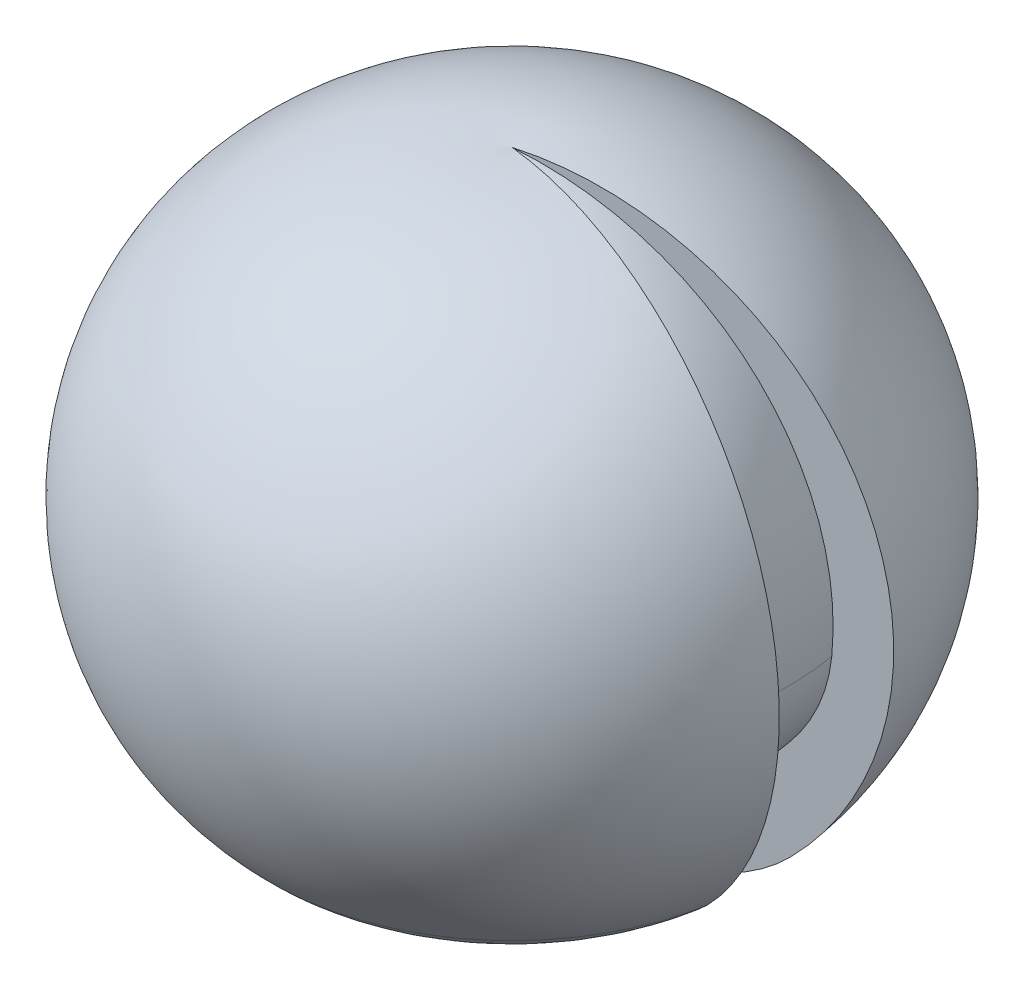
SolidWorks part; units mm, degrees
ref_plane "Front" through (0, 0, 0) normal (0, 0, 1) x (1, 0, 0)
ref_plane "Top" through (0, 0, 0) normal (0, 1, 0) x (1, 0, 0)
ref_plane "Right" through (0, 0, 0) normal (1, 0, 0) x (0, 0, -1)
sketch "Sketch1" plane through (0, 0, 0) normal (0, 0, 1) x (1, 0, 0)
  line L0 (0, 0) -> (0, 365) construction
  line L1 (0, 365) -> (-50, 365) construction
  line L2 (-50, 365) -> (-50, 635) construction
  line L3 (-50, 635) -> (-50, 685) construction
  line L4 (-50, 685) -> (-355.9412, 685) construction
  line L5 (-355.9412, 685) -> (-50, 635) construction
  line L6 (-50, 635) -> (0, 635) construction
  dimension "D1" = 365
  dimension "D2" = 270
  dimension "D3" = 50
  dimension "D4" = 50
  dimension "D5" = 310
  dimension "D6" = 90
sketch "Sketch2" plane through (0, 0, 0) normal (0, 0, 1) x (1, 0, 0)
  line L0 (0, 0) -> (0, 365) construction
  line L1 (0, 365) -> (-50, 365) construction
  line L2 (-50, 365) -> (-240.9188, 174.0812) construction
  line L3 (-240.9188, 174.0812) -> (-223.8178, 127.0965) construction
  line L4 (-223.8178, 127.0965) -> (63.6728, 231.7346) construction
  line L5 (63.6728, 231.7346) -> (-240.9188, 174.0812) construction
  line L6 (-50, 365) -> (-50, 635) construction
  line L7 (-50, 635) -> (-50, 685) construction
  line L8 (-355.9412, 685) -> (-50, 635) construction
  line L9 (-240.9188, 174.0812) -> (-276.2742, 209.4365) construction
  dimension "D1" = 135
  dimension "D2" = 155
sketch "Sketch3" plane through (0, 0, 0) normal (0, 0, 1) x (1, 0, 0)
  line L0 (0, 0) -> (0, 365) construction
  line L1 (0, 365) -> (-50, 365) construction
  line L2 (-50, 365) -> (-240.9188, 174.0812) construction
  line L3 (-240.9188, 174.0812) -> (-281.5137, 203.2711) construction
  line L4 (-281.5137, 203.2711) -> (-460.1219, -45.1219) construction
  line L5 (-460.1219, -45.1219) -> (-240.9188, 174.0812) construction
  line L6 (-50, 365) -> (-50, 635) construction
  line L7 (-355.9412, 685) -> (-50, 635) construction
  line L8 (-50, 635) -> (-50, 685) construction
  line L9 (-240.9188, 174.0812) -> (-276.2742, 209.4365) construction
  dimension "D1" = 135
  dimension "D2" = 9.282
sketch "Sketch4" plane through (0, 0, 0) normal (0, 0, 1) x (1, 0, 0)
  line L0 (0, 0) -> (0, 365) construction
  line L1 (0, 365) -> (-50, 365) construction
  line L2 (-50, 365) -> (218.9726, 341.4679) construction
  line L3 (218.9726, 341.4679) -> (222.7057, 291.6075) construction
  line L4 (222.7057, 291.6075) -> (527.7929, 314.4497) construction
  line L5 (527.7929, 314.4497) -> (218.9726, 341.4679) construction
  line L6 (218.9726, 341.4679) -> (214.6148, 291.6582) construction
  line L7 (-50, 365) -> (-50, 635) construction
  line L8 (-50, 635) -> (-50, 685) construction
  line L9 (-355.9412, 685) -> (-50, 635) construction
  dimension "D1" = 9.282
  dimension "D2" = 95
sketch "Sketch6" plane through (0, 0, 0) normal (0, 0, 1) x (1, 0, 0)
  line L0 (0, 0) -> (0, 365) construction
  line L1 (0, 365) -> (-50, 365) construction
  line L2 (-50, 365) -> (218.9726, 341.4679) construction
  line L3 (218.9726, 341.4679) -> (169.1628, 345.8257) construction
  line L4 (169.1628, 345.8257) -> (142.4983, 41.0488) construction
  line L5 (142.4983, 41.0488) -> (218.9726, 341.4679) construction
  line L6 (218.9726, 341.4679) -> (214.6148, 291.6582) construction
  line L7 (-50, 365) -> (-50, 635) construction
  line L8 (-50, 635) -> (-50, 685) construction
  line L9 (-355.9412, 685) -> (-50, 635) construction
  dimension "D1" = 95
  dimension "D2" = 90
sketch "Sketch8" plane through (0, 0, 0) normal (0, 0, 1) x (1, 0, 0)
  line L0 (0, 0) -> (0, 365) construction
  line L1 (0, 365) -> (-50, 365) construction
  line L2 (-50, 365) -> (218.9726, 341.4679) construction
  line L3 (218.9726, 341.4679) -> (243.9726, 384.7692) construction
  line L4 (243.9726, 384.7692) -> (-20.9803, 537.7398) construction
  line L5 (-20.9803, 537.7398) -> (218.9726, 341.4679) construction
  line L6 (218.9726, 341.4679) -> (214.6148, 291.6582) construction
  line L7 (-50, 635) -> (-50, 685) construction
  line L8 (-50, 365) -> (-50, 635) construction
  line L9 (-355.9412, 685) -> (-50, 635) construction
  dimension "D1" = 95
  dimension "D2" = 155
sketch "Sketch9" plane through (0, 0, 0) normal (0, 0, 1) x (1, 0, 0)
  line L0 (0, 0) -> (0, 365) construction
  line L1 (0, 0) -> (0, 365) construction
  line L2 (0, 365) -> (-50, 365) construction
  line L3 (-50, 365) -> (218.9726, 341.4679) construction
  line L4 (218.9726, 341.4679) -> (267.5781, 353.1942) construction
  line L5 (267.5781, 353.1942) -> (195.8274, 650.6027) construction
  line L6 (195.8274, 650.6027) -> (218.9726, 341.4679) construction
  line L7 (218.9726, 341.4679) -> (214.6148, 291.6582) construction
  line L8 (-50, 365) -> (-113.3085, 627.4729) construction
  line L9 (-113.3085, 627.4729) -> (-101.5847, 578.8668) construction
  line L10 (-101.5847, 578.8668) -> (195.8274, 650.6027) construction
  line L11 (195.8274, 650.6027) -> (-113.3085, 627.4729) construction
  line L12 (-113.3085, 627.4729) -> (-64.7025, 639.1967) construction
  line L13 (-50, 635) -> (-50, 685) construction
  line L14 (-355.9412, 685) -> (-50, 635) construction
  line L17 (-50, 365) -> (-50, 635) construction
  dimension "D1" = 90
  dimension "D2" = 13.561
  dimension "D3" = 95
  dimension "D4" = 108.564
sketch "Sketch5" plane through (0, 0, 0) normal (0, 0, 1) x (1, 0, 0)
  line L0 (222.7057, 291.6075) -> (527.7929, 314.4497) construction
  line L2 (0, 365) -> (-50, 365) construction
  line L3 (-50, 365) -> (218.9726, 341.4679) construction
  line L4 (218.9726, 341.4679) -> (243.9726, 384.7692) construction
  line L5 (-20.9803, 537.7398) -> (218.9726, 341.4679) construction
  line L6 (0, 0) -> (0, 365) construction
  arc A0 (63.6728, 231.7346) -> (-460.1219, -45.1219) centre (-240.9188, 174.0812) cw
  arc A1 (-460.1219, -45.1219) -> (527.7929, 314.4497) centre (-50, 365) cw
  arc A2 (63.6728, 231.7346) -> (-20.9803, 537.7398) centre (-50, 365) cw
  arc A3 (527.7929, 314.4497) -> (142.4983, 41.0488) centre (218.9726, 341.4679) cw
  arc A4 (142.4983, 41.0488) -> (195.8274, 650.6027) centre (-50, 365) ccw
  arc A5 (-20.9803, 537.7398) -> (195.8274, 650.6027) centre (218.9726, 341.4679) cw
  point P21 (-630, 365)
  point P32 (530, 365)
  point P36 (-50, 945)
  point P37 (-240.9188, -135.9188)
  dimension "D1" = 630
  dimension "D2" = 530
  dimension "D3" = 135.9188
  dimension "D4" = 1080.9188
sketch "Sketch10" plane through (0, 0, 0) normal (0, 0, 1) x (1, 0, 0)
  line L0 (0, 0) -> (0, 365) construction
  line L1 (0, -21.0037) -> (0, 197.1275)
  line L3 (0, 560.9013) -> (0, 942.8408)
  arc A0 (-460.1219, -45.1219) -> (63.6728, 231.7346) centre (-240.9188, 174.0812) ccw construction
  arc A1 (527.7929, 314.4497) -> (-460.1219, -45.1219) centre (-50, 365) ccw construction
  arc A2 (-20.9803, 537.7398) -> (63.6728, 231.7346) centre (-50, 365) ccw construction
  arc A3 (195.8274, 650.6027) -> (-20.9803, 537.7398) centre (218.9726, 341.4679) ccw construction
  arc A4 (-460.1219, -45.1219) -> (0, -21.0037) centre (-240.9188, 174.0812) ccw
  arc A5 (0, 942.8408) -> (-460.1219, -45.1219) centre (-50, 365) ccw
  arc A6 (-20.9803, 537.7398) -> (0, 197.1275) centre (-50, 365) ccw
  arc A7 (0, 560.9013) -> (-20.9803, 537.7398) centre (218.9726, 341.4679) ccw
revolve "Revolve1" add sketch "Sketch10" angle 340 mid plane about L1
sketch "Sketch11" plane through (0, 0, 0) normal (0, 0, 1) x (1, 0, 0)
  line L0 (0, 0) -> (0, 365) construction
  line L1 (0, -21.0037) -> (0, 197.1275)
  line L2 (0, 560.9013) -> (0, 942.8408)
  arc A0 (-460.1219, -45.1219) -> (63.6728, 231.7346) centre (-240.9188, 174.0812) ccw construction
  arc A1 (0, -21.0037) -> (63.6728, 231.7346) centre (-240.9188, 174.0812) ccw
  arc A2 (-20.9803, 537.7398) -> (63.6728, 231.7346) centre (-50, 365) ccw construction
  arc A3 (195.8274, 650.6027) -> (-20.9803, 537.7398) centre (218.9726, 341.4679) ccw construction
  arc A4 (142.4983, 41.0488) -> (195.8274, 650.6027) centre (-50, 365) ccw construction
  arc A5 (142.4983, 41.0488) -> (527.7929, 314.4497) centre (218.9726, 341.4679) ccw construction
  arc A6 (527.7929, 314.4497) -> (-460.1219, -45.1219) centre (-50, 365) ccw construction
  arc A7 (0, 197.1275) -> (63.6728, 231.7346) centre (-50, 365) ccw
  arc A8 (195.8274, 650.6027) -> (0, 560.9013) centre (218.9726, 341.4679) ccw
  arc A9 (142.4983, 41.0488) -> (195.8274, 650.6027) centre (-50, 365) ccw
  arc A10 (142.4983, 41.0488) -> (527.7929, 314.4497) centre (218.9726, 341.4679) ccw
  arc A11 (527.7929, 314.4497) -> (0, 942.8408) centre (-50, 365) ccw
revolve "Revolve2" add sketch "Sketch11" angle 340 mid plane about L2
